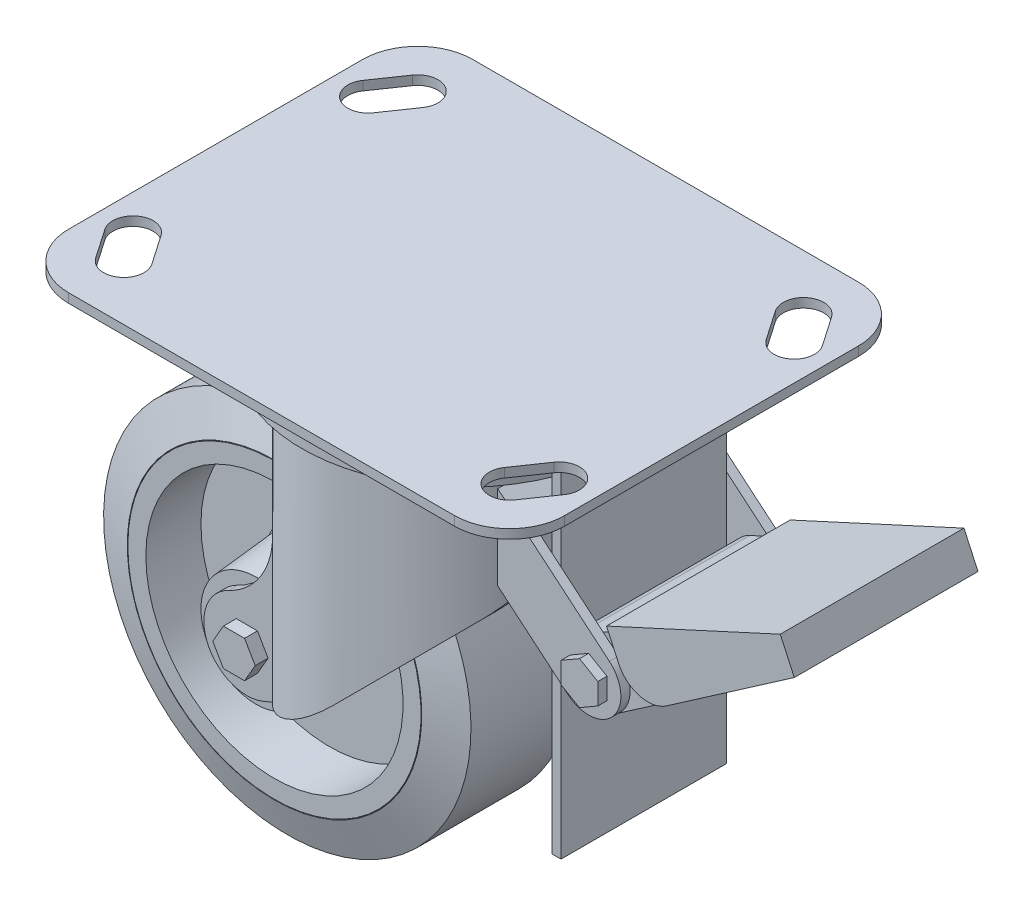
SolidWorks part; units mm, degrees
ref_plane "Plan de face" through (0, 0, 0) normal (0, 0, 1) x (1, 0, 0)
ref_plane "Plan de dessus" through (0, 0, 0) normal (0, 1, 0) x (1, 0, 0)
ref_plane "Plan de droite" through (0, 0, 0) normal (1, 0, 0) x (0, 0, -1)
imported_body "Importée3"
sketch "Esquisse2" plane through (0, 0, 22.5) normal (0, 0, 1) x (1, 0, 0)
  line L0 (50.2548, -21.9788) -> (50.2548, -49.7095)
  line L1 (55.3619, -42.0262) -> (60.4099, -39.7071)
  line L2 (60.4099, -39.7071) -> (64.9305, -37.6304)
  line L3 (64.9305, -37.6304) -> (112.2232, -15.9045)
  line L4 (112.2232, -15.9045) -> (115, -21.949)
  line L5 (115, -21.949) -> (64.0171, -57.2166)
  line L6 (50.2548, -50.2905) -> (50.2548, -50.9452)
  line L7 (50.2548, -50.9452) -> (46.5, -50.9452)
  line L8 (39.2821, -50.9452) -> (39.2821, -44.8887)
  line L9 (39.2821, -44.8887) -> (34.2821, -40.6932)
  line L10 (34.2821, -40.6932) -> (34.2821, -17.7833)
  line L11 (34.2821, -17.7833) -> (39.2821, -21.9788)
  line L12 (39.2821, -21.9788) -> (50.2548, -21.9788)
  arc A0 (50.2548, -49.7095) -> (55.3619, -42.0262) centre (59.025, -50) cw
  arc A1 (64.0171, -57.2166) -> (50.2548, -50.2905) centre (59.025, -50) cw
  spline S0 degree 3 poles (39.2821, -50.9452) (41.688, -50.9452) (44.094, -50.9452) (46.5, -50.9452) knots 0 0 0 0 1 1 1 1
extrude "Boss.-Extru.1" add sketch "Esquisse2" along normal blind 0.7557
sketch "Esquisse3" plane through (0, 0, 23.2557) normal (0, 0, 1) x (1, 0, 0)
  line L0 (50.2548, -49.7095) -> (50.2548, -21.9788)
  line L1 (50.2548, -21.9788) -> (39.2821, -21.9788)
  line L2 (39.2821, -21.9788) -> (34.4869, -17.9551)
  line L3 (34.4869, -17.9551) -> (34.2821, -17.7833)
  line L4 (34.2821, -17.7833) -> (34.2821, -18.0738)
  line L5 (34.2821, -18.0738) -> (34.2821, -40.6932)
  line L6 (34.2821, -40.6932) -> (39.2821, -44.8887)
  line L7 (39.2821, -44.8887) -> (39.2821, -50.9452)
  line L8 (46.5, -50.9452) -> (50.2548, -50.9452)
  line L9 (50.2548, -50.9452) -> (50.2548, -50.2905)
  line L10 (64.0171, -57.2166) -> (115, -21.949)
  line L11 (115, -21.949) -> (112.2232, -15.9045)
  line L12 (112.2232, -15.9045) -> (64.9305, -37.6304)
  line L13 (64.9305, -37.6304) -> (60.4099, -39.7071)
  line L14 (60.4099, -39.7071) -> (55.3619, -42.0262)
  arc A0 (50.2548, -50.2905) -> (64.0171, -57.2166) centre (59.025, -50) ccw
  arc A1 (55.3619, -42.0262) -> (50.2548, -49.7095) centre (59.025, -50) ccw
  spline S0 degree 3 poles (39.2821, -50.9452) (41.688, -50.9452) (44.094, -50.9452) (46.5, -50.9452) knots 0 0 0 0 1 1 1 1
extrude "Enlèv. mat.-Extru.1" cut sketch "Esquisse3" against normal blind 0.7557
sketch "Esquisse4" plane through (0, 0, -22.5) normal (0, 0, -1) x (-1, 0, 0)
  line L0 (-39.2821, -21.9788) -> (-34.2821, -17.7833)
  line L1 (-34.2821, -17.7833) -> (-34.2821, -40.6932)
  line L2 (-34.2821, -40.6932) -> (-39.2821, -44.8887)
  line L3 (-39.2821, -44.8887) -> (-39.2821, -50.9452)
  line L4 (-46.5, -50.9452) -> (-50.2548, -50.9452)
  line L5 (-50.2548, -50.9452) -> (-50.2548, -50.2905)
  line L6 (-64.0171, -57.2166) -> (-115, -21.949)
  line L7 (-115, -21.949) -> (-112.2232, -15.9045)
  line L8 (-112.2232, -15.9045) -> (-64.9305, -37.6304)
  line L9 (-64.9305, -37.6304) -> (-60.4099, -39.7071)
  line L10 (-60.4099, -39.7071) -> (-55.3619, -42.0262)
  line L11 (-50.2548, -49.7095) -> (-50.2548, -21.9788)
  line L12 (-50.2548, -21.9788) -> (-39.2821, -21.9788)
  arc A0 (-50.2548, -50.2905) -> (-64.0171, -57.2166) centre (-59.025, -50) cw
  arc A1 (-55.3619, -42.0262) -> (-50.2548, -49.7095) centre (-59.025, -50) cw
  spline S0 degree 3 poles (-39.2821, -50.9452) (-41.688, -50.9452) (-44.094, -50.9452) (-46.5, -50.9452) knots 0 0 0 0 1 1 1 1
extrude "Boss.-Extru.2" add sketch "Esquisse4" along normal blind 0.7557
sketch "Esquisse5" plane through (0, 0, -23.2557) normal (0, 0, -1) x (-1, 0, 0)
  line L0 (-34.4869, -17.9551) -> (-39.2821, -21.9788)
  line L1 (-39.2821, -21.9788) -> (-50.2548, -21.9788)
  line L2 (-50.2548, -21.9788) -> (-50.2548, -49.7095)
  line L3 (-55.3619, -42.0262) -> (-60.4099, -39.7071)
  line L4 (-60.4099, -39.7071) -> (-64.9305, -37.6304)
  line L5 (-64.9305, -37.6304) -> (-112.2232, -15.9045)
  line L6 (-112.2232, -15.9045) -> (-115, -21.949)
  line L7 (-115, -21.949) -> (-64.0171, -57.2166)
  line L8 (-50.2548, -50.2905) -> (-50.2548, -50.9452)
  line L9 (-50.2548, -50.9452) -> (-46.5, -50.9452)
  line L10 (-39.2821, -50.9452) -> (-39.2821, -44.8887)
  line L11 (-39.2821, -44.8887) -> (-34.2821, -40.6932)
  line L12 (-34.2821, -40.6932) -> (-34.2821, -18.0738)
  line L13 (-34.2821, -18.0738) -> (-34.2821, -17.7833)
  line L14 (-34.2821, -17.7833) -> (-34.4869, -17.9551)
  arc A0 (-50.2548, -49.7095) -> (-55.3619, -42.0262) centre (-59.025, -50) ccw
  arc A1 (-64.0171, -57.2166) -> (-50.2548, -50.2905) centre (-59.025, -50) ccw
  spline S0 degree 3 poles (-39.2821, -50.9452) (-41.688, -50.9452) (-44.094, -50.9452) (-46.5, -50.9452) knots 0 0 0 0 1 1 1 1
extrude "Enlèv. mat.-Extru.2" cut sketch "Esquisse5" against normal blind 0.7557
sketch "Esquisse6" plane through (0, 0, -22.5) normal (0, 0, -1) x (-1, 0, 0)
  line L0 (-64.6655, -43.278) -> (-34.2821, -17.7833)
  line L1 (-34.2821, -17.7833) -> (-34.2821, -40.6932)
  line L2 (-34.2821, -40.6932) -> (-53.3845, -56.722)
  arc A0 (-53.3845, -56.722) -> (-64.6655, -43.278) centre (-59.025, -50) cw
extrude "Boss.-Extru.3" add sketch "Esquisse6" along normal blind 0.7557
sketch "Esquisse7" plane through (0, 0, -23.2557) normal (0, 0, -1) x (-1, 0, 0)
  line L0 (-64.6655, -43.278) -> (-34.2821, -17.7833)
  line L1 (-34.2821, -17.7833) -> (-34.2821, -40.6932)
  line L2 (-34.2821, -40.6932) -> (-53.3845, -56.722)
  arc A0 (-53.3845, -56.722) -> (-64.6655, -43.278) centre (-59.025, -50) cw
extrude "Boss.-Extru.4" add sketch "Esquisse7" along normal blind 1.7443
sketch "Esquisse8" plane through (0, -21.9788, 0) normal (0, 1, 0) x (-1, 0, 0)
  line L0 (-50.2548, -22.5) -> (-46.5, -22.5)
  line L1 (-46.5, -22.5) -> (-39.2821, -22.5)
  line L2 (-39.2821, -22.5) -> (-39.2821, 22.5)
  line L3 (-39.2821, 22.5) -> (-50.2548, 22.5)
  line L4 (-50.2548, 22.5) -> (-50.2548, -22.5)
extrude "Enlèv. mat.-Extru.3" cut sketch "Esquisse8" against normal blind 6.0566
sketch "Esquisse9" plane through (0, 0, 22.5) normal (0, 0, 1) x (1, 0, 0)
  line L0 (53.3845, -56.722) -> (34.2821, -40.6932)
  line L1 (34.2821, -40.6932) -> (34.2821, -17.7833)
  line L2 (34.2821, -17.7833) -> (64.6655, -43.278)
  arc A0 (64.6655, -43.278) -> (53.3845, -56.722) centre (59.025, -50) cw
extrude "Boss.-Extru.5" add sketch "Esquisse9" along normal blind 0.7557
ref_plane "Plan2" through (0, -28.0353, 0) normal (0, 1, 0) x (1, 0, 0)
sketch "Esquisse13" plane through (0, -28.0353, 0) normal (0, 1, 0) x (1, 0, 0)
  line L0 (50.2548, 22.5) -> (49, 22.5)
  line L1 (49, 22.5) -> (39.2821, 22.5)
  line L2 (39.2821, 22.5) -> (39.2821, -22.5)
  line L3 (39.2821, -22.5) -> (49, -22.5)
  line L4 (49, -22.5) -> (50.2548, -22.5)
  line L5 (50.2548, -22.5) -> (50.2548, 22.5)
extrude "Enlèv. mat.-Extru.4" cut sketch "Esquisse13" against normal blind 2.0977
sketch "Esquisse14" plane through (39.2821, 0, 0) normal (-1, 0, 0) x (0, 0, 1)
  line L0 (22.5, -50.9452) -> (22.5, -30.1331)
  line L1 (22.5, -30.1331) -> (-22.5, -30.1331)
  line L2 (-22.5, -30.1331) -> (-22.5, -50.9452)
  line L3 (-22.5, -50.9452) -> (22.5, -50.9452)
extrude "Enlèv. mat.-Extru.5" cut sketch "Esquisse14" against normal blind 7.2179
sketch "Esquisse15" plane through (0, -30.1331, 0) normal (0, 1, 0) x (-1, 0, 0)
  line L0 (-46.5, -22.5) -> (-50.2548, -22.5)
  line L1 (-50.2548, -22.5) -> (-50.2548, 22.5)
  line L2 (-50.2548, 22.5) -> (-46.5, 22.5)
  line L3 (-46.5, 22.5) -> (-46.5, -22.5)
extrude "Boss.-Extru.6" add sketch "Esquisse15" along normal blind 2.0977
ref_plane "Plan3" through (0, -50.9452, 0) normal (0, -1, 0) x (-1, 0, 0)
sketch "Esquisse20" plane through (0, -50.9452, 0) normal (0, -1, 0) x (-1, 0, 0)
  line L0 (-50.2548, 22.5) -> (-46.5, 22.5)
  line L1 (-46.5, 22.5) -> (-46.5, -22.5)
  line L2 (-46.5, -22.5) -> (-50.2548, -22.5)
  line L3 (-50.2548, -22.5) -> (-50.2548, 22.5)
extrude "Boss.-Extru.7" add sketch "Esquisse20" along normal blind 3.1507
sketch "Esquisse21" plane through (0, -28.0353, 0) normal (0, 1, 0) x (-1, 0, 0)
  line L0 (-46.5, -22.5) -> (-49, -22.5)
  line L1 (-50.2548, -22.5) -> (-50.2548, 22.5)
  line L2 (-49, 22.5) -> (-46.5, 22.5)
  line L3 (-46.5, 22.5) -> (-46.5, -22.5)
  spline S0 degree 3 poles (-50.2548, -22.5) (-49.8365, -22.5) (-49.4183, -22.5) (-49, -22.5) knots 0 0 0 0 1 1 1 1
  spline S1 degree 3 poles (-50.2548, 22.5) (-49.8365, 22.5) (-49.4183, 22.5) (-49, 22.5) knots 0 0 0 0 1 1 1 1
extrude "Boss.-Extru.8" add sketch "Esquisse21" along normal blind 22.0353
ref_plane "Plan4" through (0, -54.0959, 0) normal (0, -1, 0) x (-1, 0, 0)
sketch "Esquisse27" plane through (0, -54.0959, 0) normal (0, -1, 0) x (-1, 0, 0)
  line L0 (-49, 22.5) -> (-46.5, 22.5)
  line L1 (-46.5, 22.5) -> (-46.5, -22.5)
  line L2 (-46.5, -22.5) -> (-49, -22.5)
  line L3 (-50.2548, -22.5) -> (-50.2548, 22.5)
  spline S0 degree 3 poles (-50.2548, -22.5) (-49.8365, -22.5) (-49.4183, -22.5) (-49, -22.5) knots 0 0 0 0 1 1 1 1
  spline S1 degree 3 poles (-50.2548, 22.5) (-49.8365, 22.5) (-49.4183, 22.5) (-49, 22.5) knots 0 0 0 0 1 1 1 1
extrude "Boss.-Extru.9" add sketch "Esquisse27" along normal blind 44.9041
sketch "Esquisse28" plane through (50.2548, 0, 0) normal (1, 0, 0) x (0, 0, -1)
  line L0 (22.5, -99) -> (22.5, -53.043)
  line L1 (22.5, -53.043) -> (22.5, -30.1331)
  line L2 (22.5, -30.1331) -> (22.5, -6)
  line L3 (22.5, -6) -> (-22.5, -6)
  line L4 (-22.5, -6) -> (-22.5, -30.1331)
  line L5 (-22.5, -30.1331) -> (-22.5, -53.043)
  line L6 (-22.5, -53.043) -> (-22.5, -99)
  line L7 (-22.5, -99) -> (22.5, -99)
extrude "Enlèv. mat.-Extru.6" cut sketch "Esquisse28" against normal blind 1.2548
sketch "Esquisse29" plane through (0, 0, 23.2557) normal (0, 0, 1) x (1, 0, 0)
  line L0 (53.3845, -56.722) -> (34.2821, -40.6932)
  line L1 (34.2821, -40.6932) -> (34.2821, -17.7833)
  line L2 (34.2821, -17.7833) -> (64.6655, -43.278)
  arc A0 (64.6655, -43.278) -> (53.3845, -56.722) centre (59.025, -50) cw
extrude "Boss.-Extru.10" add sketch "Esquisse29" along normal blind 1.7443
sketch "Esquisse30" plane through (0, 0, -22.5) normal (0, 0, -1) x (-1, 0, 0)
  line L0 (-112.2232, -15.9045) -> (-64.9305, -37.6304)
  line L1 (-64.9305, -37.6304) -> (-71.5382, -52.0139)
  line L2 (-71.5382, -52.0139) -> (-115, -21.949)
  line L3 (-115, -21.949) -> (-112.2232, -15.9045)
extrude "Boss.-Extru.11" add sketch "Esquisse30" along normal blind 2.5
sketch "Esquisse31" plane through (25.5896, -55.7033, 0) normal (-0.4174, 0.9087, 0) x (-0.9087, -0.4174, 0)
  line L0 (-43.2936, 22.5) -> (-43.2936, -25)
  line L1 (-43.2936, -25) -> (-95.3379, -25)
  line L2 (-95.3379, -25) -> (-95.3379, 22.5)
  line L3 (-95.3379, 22.5) -> (-43.2936, 22.5)
extrude "Boss.-Extru.12" add sketch "Esquisse31" along normal blind 2.5
sketch "Esquisse32" plane through (0, 0, 22.5) normal (0, 0, 1) x (1, 0, 0)
  line L0 (115, -21.949) -> (71.5382, -52.0139)
  line L1 (71.5382, -52.0139) -> (63.8869, -35.3587)
  line L2 (63.8869, -35.3587) -> (111.1796, -13.6328)
  line L3 (111.1796, -13.6328) -> (115, -21.949)
extrude "Boss.-Extru.13" add sketch "Esquisse32" along normal blind 2.5
sketch "Esquisse33" plane through (0, 0, -25) normal (0, 0, -1) x (-1, 0, 0)
  line L0 (-59.025, -55.7735) -> (-64.025, -52.8868)
  line L1 (-64.025, -52.8868) -> (-64.025, -47.1132)
  line L2 (-64.025, -47.1132) -> (-59.025, -44.2265)
  line L3 (-59.025, -44.2265) -> (-54.025, -47.1132)
  line L4 (-54.025, -47.1132) -> (-54.025, -52.8868)
  line L5 (-54.025, -52.8868) -> (-59.025, -55.7735)
extrude "Boss.-Extru.14" add sketch "Esquisse33" along normal blind 2.5
sketch "Esquisse34" plane through (0, 0, 25) normal (0, 0, 1) x (1, 0, 0)
  line L0 (59.025, -55.7735) -> (54.025, -52.8868)
  line L1 (54.025, -52.8868) -> (54.025, -47.1132)
  line L2 (54.025, -47.1132) -> (59.025, -44.2265)
  line L3 (59.025, -44.2265) -> (64.025, -47.1132)
  line L4 (64.025, -47.1132) -> (64.025, -52.8868)
  line L5 (64.025, -52.8868) -> (59.025, -55.7735)
extrude "Boss.-Extru.15" add sketch "Esquisse34" along normal blind 2.5
sketch "Esquisse35" plane through (0, 0, -25) normal (0, 0, -1) x (-1, 0, 0)
  line L0 (39.7735, -89) -> (36.8868, -94)
  line L1 (36.8868, -94) -> (31.1132, -94)
  line L2 (31.1132, -94) -> (28.2265, -89)
  line L3 (28.2265, -89) -> (31.1132, -84)
  line L4 (31.1132, -84) -> (36.8868, -84)
  line L5 (36.8868, -84) -> (39.7735, -89)
extrude "Boss.-Extru.16" add sketch "Esquisse35" along normal blind 3.51
sketch "Esquisse36" plane through (0, 0, 25) normal (0, 0, 1) x (1, 0, 0)
  line L0 (-28.2265, -89) -> (-31.1132, -94)
  line L1 (-31.1132, -94) -> (-36.8868, -94)
  line L2 (-36.8868, -94) -> (-39.7735, -89)
  line L3 (-39.7735, -89) -> (-36.8868, -84)
  line L4 (-36.8868, -84) -> (-31.1132, -84)
  line L5 (-31.1132, -84) -> (-28.2265, -89)
extrude "Boss.-Extru.17" add sketch "Esquisse36" along normal blind 3.51
chamfer "Chanfrein1" distance 1 angle 42.5 2 edges at (-50.7498, -89, -2.5) (-17.2502, -89, 2.5)
fillet "Congé1" radius 8.775 2 edges at (71.5382, -52.0139, 23.75) (71.5382, -52.0139, -23.75)
ref_plane "Plan5" through (0, -2.5, 0) normal (0, -1, 0) x (-1, 0, 0)
sketch "Esquisse43" plane through (0, -2.5, 0) normal (0, -1, 0) x (-1, 0, 0)
  line L0 (-47.9678, 36.8841) -> (-53.4678, 28.8841)
  line L1 (-62.5322, 35.1159) -> (-57.0322, 43.1159)
  line L2 (-53.4678, -28.8841) -> (-47.9678, -36.8841)
  line L3 (-57.0322, -43.1159) -> (-62.5322, -35.1159)
  line L4 (53.4678, 28.8841) -> (47.9678, 36.8841)
  line L5 (57.0322, 43.1159) -> (62.5322, 35.1159)
  line L6 (47.9678, -36.8841) -> (53.4678, -28.8841)
  line L7 (62.5322, -35.1159) -> (57.0322, -43.1159)
  line L8 (52.5, 55) -> (-52.5, 55)
  line L9 (-67.5, 40) -> (-67.5, -40)
  line L10 (-52.5, -55) -> (52.5, -55)
  line L11 (67.5, -40) -> (67.5, 40)
  arc A0 (-53.4678, 28.8841) -> (-62.5322, 35.1159) centre (-58, 32) cw
  arc A1 (-57.0322, 43.1159) -> (-47.9678, 36.8841) centre (-52.5, 40) cw
  arc A2 (-47.9678, -36.8841) -> (-57.0322, -43.1159) centre (-52.5, -40) cw
  arc A3 (-62.5322, -35.1159) -> (-53.4678, -28.8841) centre (-58, -32) cw
  arc A4 (62.5322, 35.1159) -> (53.4678, 28.8841) centre (58, 32) cw
  arc A5 (47.9678, 36.8841) -> (57.0322, 43.1159) centre (52.5, 40) cw
  arc A6 (57.0322, -43.1159) -> (47.9678, -36.8841) centre (52.5, -40) cw
  arc A7 (53.4678, -28.8841) -> (62.5322, -35.1159) centre (58, -32) cw
  arc A8 (67.5, 40) -> (52.5, 55) centre (52.5, 40) ccw
  arc A9 (-52.5, 55) -> (-67.5, 40) centre (-52.5, 40) ccw
  arc A10 (-67.5, -40) -> (-52.5, -55) centre (-52.5, -40) ccw
  arc A11 (52.5, -55) -> (67.5, -40) centre (52.5, -40) ccw
extrude "Boss.-Extru.18" add sketch "Esquisse43" against normal blind 2.5 separate body
ref_plane "Plan6" through (0, 0, 0) normal (0, 0, -1) x (-1, 0, 0)
sketch "Esquisse51" plane through (0, 0, 0) normal (0, 0, -1) x (-1, 0, 0)
  line L0 (0, -7.5) -> (0, -2.5) construction
  circle A0 centre (-39, -5) radius 2.5
revolve "Révolution2" add sketch "Esquisse51" angle 360 about L0
